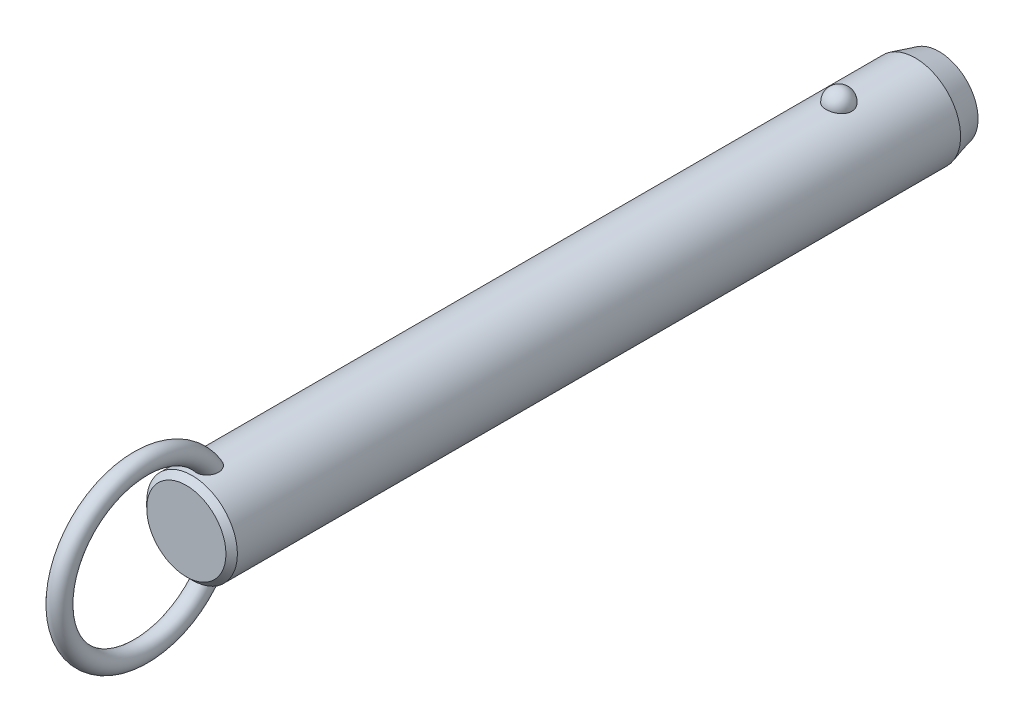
SolidWorks part; units mm, degrees
ref_plane "Front Plane" through (0, 0, 0) normal (0, 0, 1) x (1, 0, 0)
ref_plane "Top Plane" through (0, 0, 0) normal (0, 1, 0) x (1, 0, 0)
ref_plane "Right Plane" through (0, 0, 0) normal (1, 0, 0) x (0, 0, -1)
sketch "Sketch2" plane through (0, 0, 0) normal (0, 0, 1) x (1, 0, 0)
  circle A0 centre (0, 0) radius 9.5
  point P3 (0, 9.5)
  dimension "D1" = 19
extrude "Boss-Extrude1" add sketch "Sketch2" along normal blind 124.5
sketch "Sketch3" plane through (0, 0, 0) normal (0, 0, -1) x (-1, 0, 0)
  circle A0 centre (0, 0) radius 9.5
  dimension "D1" = 19
extrude "Boss-Extrude2" add sketch "Sketch3" along normal blind 23.7
chamfer "Chamfer1" distance 5 angle 15 1 edges at (-9.5, 0, -23.7)
sketch "Sketch12" plane through (0, 0, 0) normal (1, 0, 0) x (0, 0, -1)
  line L0 (-124.5, 9.5) -> (-124.5, -9.5) construction
  point P0 (-124.5, 0)
sketch "Sketch13" plane through (0, 0, 0) normal (1, 0, 0) x (0, 0, -1)
  circle A0 centre (-143.55, 0) radius 19.05
  point P2 (-124.5, 0)
  dimension "D1" = 38.1
sketch "Sketch14" plane through (0, 0, 0) normal (0, 1, 0) x (1, 0, 0)
  circle A0 centre (0, -126.5) radius 2
  point P2 (0, -124.5)
  dimension "D1" = 4
sweep "Sweep1" add profiles "Sketch14" path "Sketch13"
sketch "Sketch15" plane through (0, 0, 124.5) normal (0, 0, 1) x (1, 0, 0)
  circle A0 centre (0, 0) radius 9.5
  dimension "D1" = 19
extrude "Boss-Extrude3" add sketch "Sketch15" along normal blind 9.52
chamfer "Chamfer2" distance 1.2 angle 45 1 edges at (9.5, 0, 134.02)
sketch "Sketch18" plane through (0, 0, 0) normal (1, 0, 0) x (0, 0, -1)
  line L0 (18.7, 9.5) -> (-127.0378, 9.5) construction
  line L1 (2.7, 12.2) -> (2.7, 6.8)
  line L2 (-127.0378, -9.5) -> (18.7, -9.5) construction
  arc A0 (2.7, 12.2) -> (2.7, 6.8) centre (2.7, 9.5) ccw
  point P4 (0, 9.5)
  dimension "D1" = 21.7
revolve "Revolve1" add sketch "Sketch18" angle 360 about L1
